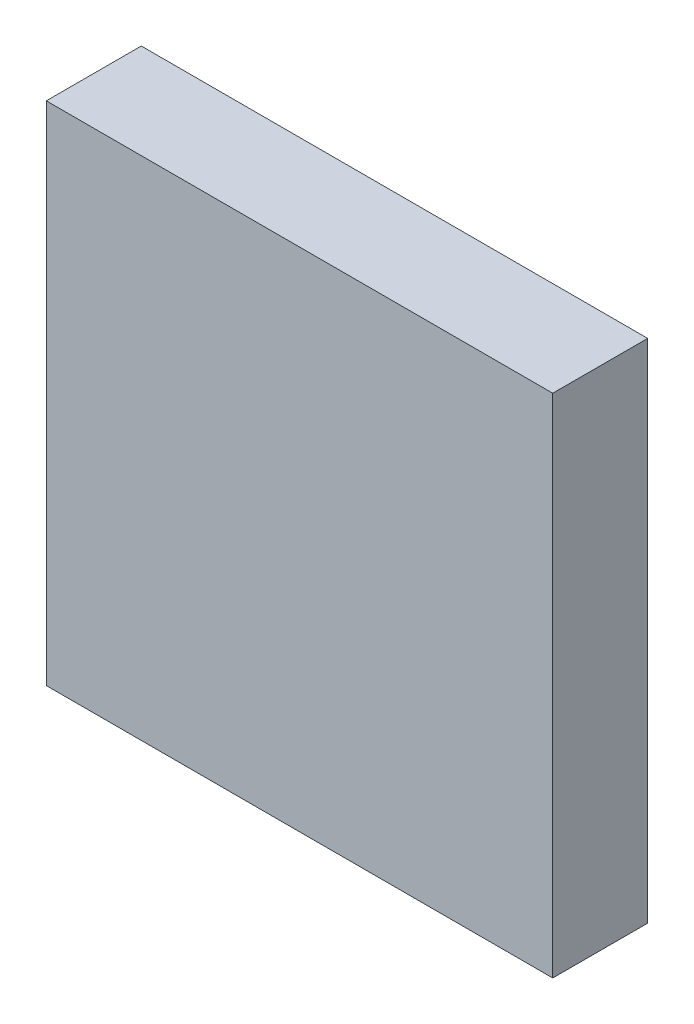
SolidWorks part; units mm, degrees
ref_plane "Front Plane" through (0, 0, 0) normal (0, 0, 1) x (1, 0, 0)
ref_plane "Top Plane" through (0, 0, 0) normal (0, 1, 0) x (1, 0, 0)
ref_plane "Right Plane" through (0, 0, 0) normal (1, 0, 0) x (0, 0, -1)
sketch "Sketch1" plane through (0, 0, 0) normal (0, 1, 0) x (1, 0, 0)
  line L1 (0, 0) -> (101.6, 0)
  line L2 (0, 0) -> (0, 19.05)
  line L3 (0, 19.05) -> (101.6, 19.05)
  line L4 (101.6, 0) -> (101.6, 19.05)
  dimension "D1" = 19.05
  dimension "D2" = 101.6
extrude "Extrude1" add sketch "Sketch1" against normal blind 101.6
